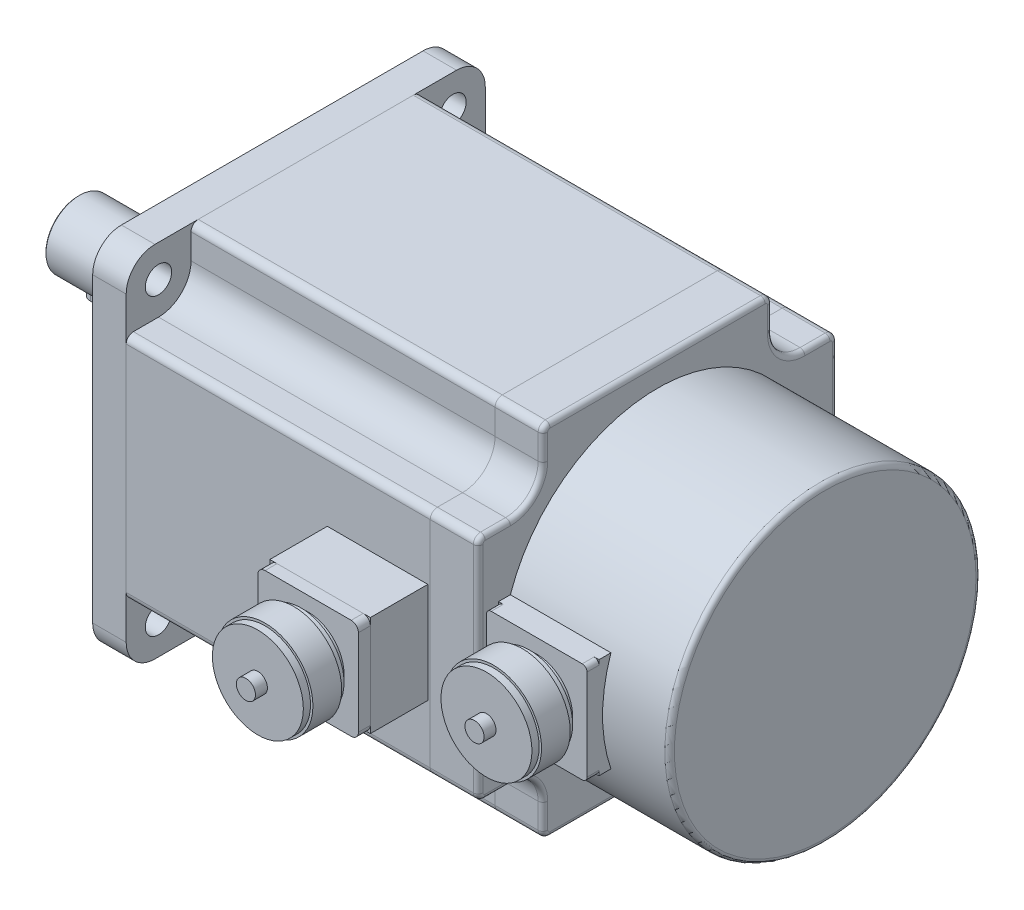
SolidWorks part; units mm, degrees
ref_plane "前视基准面" through (0, 0, 0) normal (0, 0, 1) x (1, 0, 0)
ref_plane "上视基准面" through (0, 0, 0) normal (0, 1, 0) x (1, 0, 0)
ref_plane "右视基准面" through (0, 0, 0) normal (1, 0, 0) x (0, 0, -1)
sketch "草图1" plane through (0, 0, 0) normal (1, 0, 0) x (0, 0, -1)
  line L1 (-63, -75) -> (63, -75)
  line L2 (-75, -63) -> (-75, 63)
  line L3 (-63, 75) -> (63, 75)
  line L4 (75, -63) -> (75, 63)
  line L5 (-75, -75) -> (75, 75) construction
  line L6 (-75, 75) -> (75, -75) construction
  arc A0 (63, -75) -> (75, -63) centre (63, -63) ccw
  arc A1 (-63, -75) -> (-75, -63) centre (-63, -63) cw
  arc A2 (-75, 63) -> (-63, 75) centre (-63, 63) cw
  arc A3 (63, 75) -> (75, 63) centre (63, 63) cw
  point P0 (0, 0)
  dimension "D1" = 12
extrude "凸台-拉伸1" add sketch "草图1" along normal blind 20
sketch "草图2" plane through (0, 0, 0) normal (-1, 0, 0) x (0, 0, 1)
  line L0 (-63, 75) -> (63, 75) construction
  line L1 (-63, -75) -> (63, -75)
  line L2 (-75, -63) -> (-75, 63)
  line L3 (-63, 75) -> (63, 75)
  line L4 (75, -63) -> (75, 63)
  line L5 (-75, -75) -> (75, 75) construction
  line L6 (-75, 75) -> (75, -75) construction
  arc A0 (63, 75) -> (75, 63) centre (63, 63) cw
  arc A1 (63, -75) -> (75, -63) centre (63, -63) ccw
  arc A2 (-63, -75) -> (-75, -63) centre (-63, -63) cw
  arc A3 (-75, 63) -> (-63, 75) centre (-63, 63) cw
  point P0 (0, 0)
  dimension "D1" = 12
extrude "凸台-拉伸2" add sketch "草图2" along normal blind 127 separate body
sketch "草图3" plane through (-127, 0, 0) normal (-1, 0, 0) x (0, 0, 1)
  line L0 (63, 75) -> (-63, 75) construction
  line L1 (-63, -75) -> (63, -75)
  line L2 (-75, -63) -> (-75, 63)
  line L3 (-63, 75) -> (63, 75)
  line L4 (75, -63) -> (75, 63)
  line L5 (-75, -75) -> (75, 75) construction
  line L6 (-75, 75) -> (75, -75) construction
  arc A0 (-63, -75) -> (-75, -63) centre (-63, -63) cw
  arc A1 (63, -75) -> (75, -63) centre (63, -63) ccw
  arc A2 (63, 75) -> (75, 63) centre (63, 63) cw
  arc A3 (-75, 63) -> (-63, 75) centre (-63, 63) cw
  point P0 (0, 0)
  dimension "D1" = 12
extrude "凸台-拉伸3" add sketch "草图3" along normal blind 14 separate body
sketch "草图4" plane through (0, 0, 75) normal (0, 0, 1) x (1, 0, 0)
  line L2 (-43, -21) -> (-1, -21)
  line L3 (-43, -21) -> (-43, 21)
  line L4 (-43, 21) -> (-1, 21)
  line L5 (-1, -21) -> (-1, 21)
  line L6 (-43, -21) -> (-1, 21) construction
  line L7 (-43, 21) -> (-1, -21) construction
extrude "凸台-拉伸4" add sketch "草图4" along normal blind 24 separate body
sketch "草图5" plane through (0, 0, 99) normal (0, 0, 1) x (1, 0, 0)
  line L0 (-1, 21) -> (-43, 21) construction
  line L1 (-40, -21) -> (-4, -21)
  line L2 (-43, -18) -> (-43, 18)
  line L3 (-40, 21) -> (-4, 21)
  line L4 (-1, -18) -> (-1, 18)
  line L5 (-43, -21) -> (-1, 21) construction
  line L6 (-43, 21) -> (-1, -21) construction
  arc A0 (-40, -21) -> (-43, -18) centre (-40, -18) cw
  arc A1 (-4, -21) -> (-1, -18) centre (-4, -18) ccw
  arc A2 (-4, 21) -> (-1, 18) centre (-4, 18) cw
  arc A3 (-43, 18) -> (-40, 21) centre (-40, 18) cw
  point P0 (-22, 0)
  dimension "D1" = 3
extrude "凸台-拉伸5" add sketch "草图5" along normal blind 5 separate body
sketch "草图6" plane through (0, 0, 104) normal (0, 0, 1) x (1, 0, 0)
  circle A0 centre (-22, 0) radius 15
extrude "凸台-拉伸6" add sketch "草图6" along normal blind 3 separate body
sketch "草图7" plane through (0, 0, 107) normal (0, 0, 1) x (1, 0, 0)
  circle A0 centre (-22, 0) radius 18
extrude "凸台-拉伸7" add sketch "草图7" along normal blind 3 separate body
sketch "草图8" plane through (0, 0, 110) normal (0, 0, 1) x (1, 0, 0)
  circle A0 centre (-22, 0) radius 20
extrude "凸台-拉伸8" add sketch "草图8" along normal blind 12 separate body
sketch "草图9" plane through (0, 0, 122) normal (0, 0, 1) x (1, 0, 0)
  circle A0 centre (-22, 0) radius 19
extrude "凸台-拉伸9" add sketch "草图9" along normal blind 3
sketch "草图10" plane through (0, 0, 125) normal (0, 0, 1) x (1, 0, 0)
  circle A0 centre (-22, 0) radius 4
extrude "凸台-拉伸10" add sketch "草图10" along normal blind 5
sketch "草图11" plane through (20, 0, 0) normal (1, 0, 0) x (0, 0, -1)
  line L0 (47.9169, -61.5) -> (47.9169, -72)
  line L1 (-75, -44.9169) -> (-75, -63)
  line L2 (-63, -75) -> (-44.9169, -75)
  line L3 (44.9169, -75) -> (63, -75)
  line L4 (75, -63) -> (75, -44.9169)
  line L6 (75, 63) -> (75, 44.9169)
  line L7 (-63, -75) -> (63, -75) construction
  line L8 (63, 75) -> (44.9169, 75)
  line L9 (-47.9169, -72) -> (-47.9169, -61.5)
  line L10 (-44.9169, 75) -> (-63, 75)
  line L11 (-61.5, -47.9169) -> (-72, -47.9169)
  line L12 (75, -63) -> (75, 63) construction
  line L13 (-75, 63) -> (-75, 44.9169)
  line L14 (-72, 47.9169) -> (-61.5, 47.9169)
  line L16 (-47.9169, 61.5) -> (-47.9169, 72)
  line L17 (63, 75) -> (-63, 75) construction
  line L19 (47.9169, 72) -> (47.9169, 61.5)
  line L21 (61.5, 47.9169) -> (72, 47.9169)
  line L22 (-75, 63) -> (-75, -63) construction
  line L24 (72, -47.9169) -> (61.5, -47.9169)
  arc A0 (-61.5, 47.9169) -> (-47.9169, 61.5) centre (-61.5, 61.5) ccw
  arc A1 (47.9169, 61.5) -> (61.5, 47.9169) centre (61.5, 61.5) ccw
  arc A2 (-47.9169, -61.5) -> (-61.5, -47.9169) centre (-61.5, -61.5) ccw
  arc A3 (-72, -47.9169) -> (-75, -44.9169) centre (-72, -44.9169) cw
  arc A4 (61.5, -47.9169) -> (47.9169, -61.5) centre (61.5, -61.5) ccw
  arc A5 (-75, 44.9169) -> (-72, 47.9169) centre (-72, 44.9169) cw
  arc A6 (-47.9169, 72) -> (-44.9169, 75) centre (-44.9169, 72) cw
  arc A7 (44.9169, 75) -> (47.9169, 72) centre (44.9169, 72) cw
  arc A8 (72, 47.9169) -> (75, 44.9169) centre (72, 44.9169) cw
  arc A9 (75, -44.9169) -> (72, -47.9169) centre (72, -44.9169) cw
  arc A10 (47.9169, -72) -> (44.9169, -75) centre (44.9169, -72) cw
  arc A11 (-44.9169, -75) -> (-47.9169, -72) centre (-44.9169, -72) cw
  arc A12 (-63, 75) -> (-75, 63) centre (-63, 63) ccw
  arc A13 (75, 63) -> (63, 75) centre (63, 63) ccw
  arc A14 (63, -75) -> (75, -63) centre (63, -63) ccw
  arc A15 (-75, -63) -> (-63, -75) centre (-63, -63) ccw
  point P0 (0, 0)
  point P1 (0, 0)
  point P12 (-75, -47.9169)
  point P43 (-75, 47.9169)
  point P47 (-47.9169, 75)
  point P48 (51.9891, -75)
  point P52 (47.9169, 75)
  point P56 (75, 47.9169)
  point P65 (75, -47.9169)
  point P82 (-47.9169, -75)
  dimension "D1" = 3
extrude "切除-拉伸2" cut sketch "草图11" against normal blind 147
fillet "圆角1" radius 2 24 edges at (20, 75, 0) (20, 0, -75) (20, -75, 0) (20, 0, 75) (20, 47.0382, 74.1213) (20, 47.9169, 66.75) (20, 51.8953, 51.8953) (20, 66.75, 47.9169) (20, 74.1213, 47.0382) (20, 74.1213, -47.0382) (20, 66.75, -47.9169) (20, 51.8953, -51.8953) (20, 47.9169, -66.75) (20, 47.0382, -74.1213) (20, -47.0382, -74.1213) (20, -47.9169, -66.75) (20, -51.8953, -51.8953) (20, -66.75, -47.9169) (20, -74.1213, -47.0382) (20, -74.1213, 47.0382) (20, -66.75, 47.9169) (20, -51.8953, 51.8953) (20, -47.9169, 66.75) (20, -47.0382, 74.1213)
sketch "草图12" plane through (-141, 0, 0) normal (-1, 0, 0) x (0, 0, 1)
  circle A2 centre (-61.5183, 61.5183) radius 5.5
  circle A3 centre (61.5183, 61.5183) radius 5.5
  circle A4 centre (-61.5183, -61.5183) radius 5.5
  circle A5 centre (61.5183, -61.5183) radius 5.5
extrude "切除-拉伸3" cut sketch "草图12" against normal blind 14
sketch "草图13" plane through (-141, 0, 0) normal (-1, 0, 0) x (0, 0, 1)
  circle A0 centre (0, 0) radius 65
  circle A1 centre (0, 0) radius 57.5
extrude "凸台-拉伸11" add sketch "草图13" along normal blind 6 separate body
sketch "草图14" plane through (-141, 0, 0) normal (-1, 0, 0) x (0, 0, 1)
  circle A0 centre (0, 0) radius 35
extrude "凸台-拉伸12" add sketch "草图14" along normal blind 6
sketch "草图15" plane through (-147, 0, 0) normal (-1, 0, 0) x (0, 0, 1)
  circle A0 centre (0, 0) radius 17.5
extrude "凸台-拉伸13" add sketch "草图15" along normal blind 3 separate body
fillet "圆角2" radius 0.5 1 edges at (-150, 0, 17.5)
sketch "草图16" plane through (-150, 0, 0) normal (-1, 0, 0) x (0, 0, 1)
  circle A0 centre (0, 0) radius 14
extrude "凸台-拉伸14" add sketch "草图16" along normal blind 72
chamfer "倒角1" distance 0.5 angle 45 1 edges at (-222, 0, 14)
ref_plane "基准面1" through (0, -14, 0) normal (0, 1, 0) x (1, 0, 0)
sketch "草图19" plane through (20, 0, 0) normal (1, 0, 0) x (0, 0, -1)
  circle A0 centre (0, 0) radius 65
extrude "凸台-拉伸16" add sketch "草图19" along normal blind 70 separate body
fillet "圆角3" radius 2 1 edges at (90, 0, -65)
ref_plane "基准面2" through (0, 0, 65) normal (0, 0, 1) x (1, 0, 0)
sketch "草图20" plane through (0, 0, 65) normal (0, 0, 1) x (1, 0, 0)
  line L1 (20, 65) -> (20, -65) construction
  line L3 (62, -21) -> (20, -21)
  line L4 (62, -21) -> (62, 21)
  line L5 (62, 21) -> (20, 21)
  line L6 (20, -21) -> (20, 21)
  line L7 (62, -21) -> (20, 21) construction
  line L8 (62, 21) -> (20, -21) construction
extrude "切除-拉伸5" cut sketch "草图20" against normal blind 10
sketch "草图21" plane through (0, 0, 55) normal (0, 0, 1) x (1, 0, 0)
  line L0 (62, 21) -> (20, 21) construction
  line L1 (20, -21) -> (62, -21)
  line L2 (20, -21) -> (20, 21)
  line L3 (20, 21) -> (62, 21)
  line L4 (62, -21) -> (62, 21)
  line L5 (20, -21) -> (62, 21) construction
  line L6 (20, 21) -> (62, -21) construction
  line L7 (20, 21) -> (62, 21) construction
  point P0 (41, 0)
extrude "凸台-拉伸17" add sketch "草图21" along normal blind 11.5
sketch "草图22" plane through (0, 0, 66.5) normal (0, 0, 1) x (1, 0, 0)
  line L0 (62, -21) -> (62, 21) construction
  line L1 (22, -21) -> (60, -21)
  line L2 (20, -19) -> (20, 19)
  line L3 (22, 21) -> (60, 21)
  line L4 (62, -19) -> (62, 19)
  line L5 (20, -21) -> (62, 21) construction
  line L6 (20, 21) -> (62, -21) construction
  line L7 (20, 21) -> (62, 21) construction
  arc A0 (22, -21) -> (20, -19) centre (22, -19) cw
  arc A1 (60, -21) -> (62, -19) centre (60, -19) ccw
  arc A2 (60, 21) -> (62, 19) centre (60, 19) cw
  arc A3 (20, 19) -> (22, 21) centre (22, 19) cw
  point P0 (41, 0)
  dimension "D1" = 2
extrude "凸台-拉伸18" add sketch "草图22" along normal blind 5 separate body
sketch "草图23" plane through (0, 0, 71.5) normal (0, 0, 1) x (1, 0, 0)
  circle A0 centre (41, 0) radius 15
extrude "凸台-拉伸19" add sketch "草图23" along normal blind 3
sketch "草图24" plane through (0, 0, 74.5) normal (0, 0, 1) x (1, 0, 0)
  circle A0 centre (41, 0) radius 18
extrude "凸台-拉伸20" add sketch "草图24" along normal blind 3
sketch "草图25" plane through (0, 0, 77.5) normal (0, 0, 1) x (1, 0, 0)
  circle A0 centre (41, 0) radius 20
extrude "凸台-拉伸21" add sketch "草图25" along normal blind 12
sketch "草图26" plane through (0, 0, 89.5) normal (0, 0, 1) x (1, 0, 0)
  circle A0 centre (41, 0) radius 19
extrude "凸台-拉伸22" add sketch "草图26" along normal blind 3
sketch "草图27" plane through (0, 0, 92.5) normal (0, 0, 1) x (1, 0, 0)
  circle A0 centre (41, 0) radius 4
extrude "凸台-拉伸23" add sketch "草图27" along normal blind 5
sketch "草图29" plane through (0, -14, 0) normal (0, 1, 0) x (1, 0, 0)
  line L5 (-213, -4) -> (-166, -4)
  line L7 (-166, 4) -> (-213, 4)
  arc A0 (-213, 4) -> (-213, -4) centre (-213, 0) ccw
  arc A1 (-166, -4) -> (-166, 4) centre (-166, 0) ccw
extrude "切除-拉伸6" cut sketch "草图29" along normal blind 4
sketch "草图30" plane through (0, -10, 0) normal (0, -1, 0) x (1, 0, 0)
  line L0 (-213, 4) -> (-166, 4)
  line L2 (-166, -4) -> (-213, -4)
  arc A0 (-213, 4) -> (-213, -4) centre (-213, 0) ccw
  arc A1 (-166, -4) -> (-166, 4) centre (-166, 0) ccw
extrude "凸台-拉伸24" add sketch "草图30" along normal blind 8 separate body
